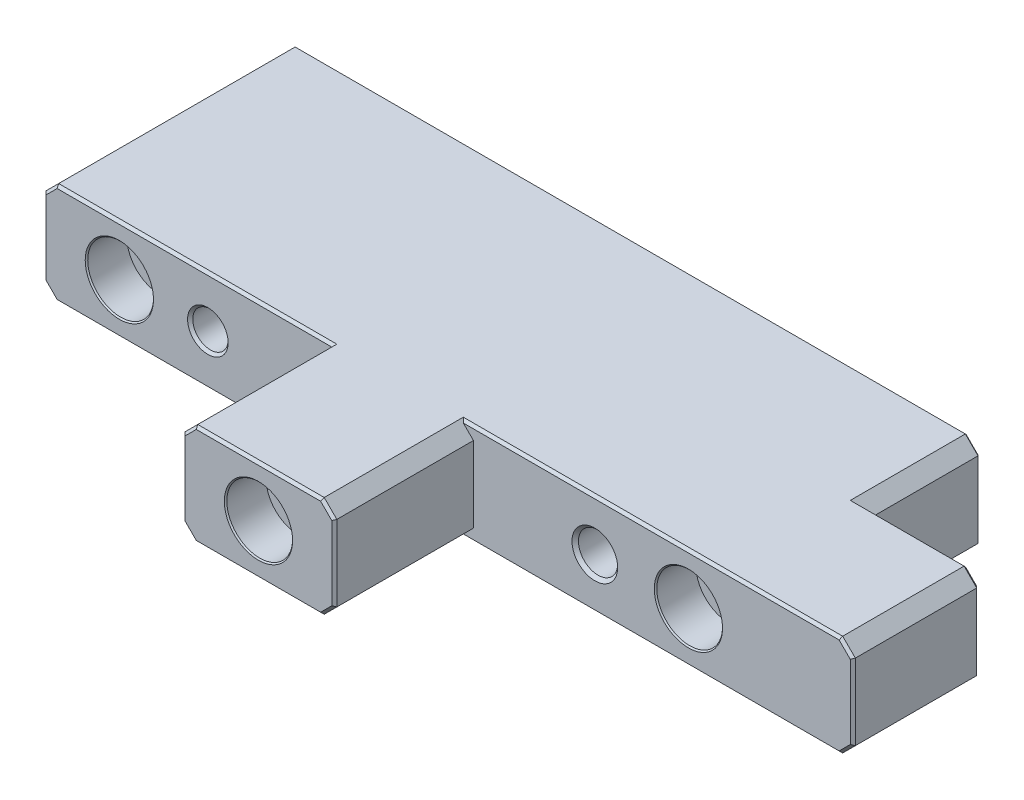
SolidWorks part; units mm, degrees
ref_plane "Plan de face" through (0, 0, 0) normal (0, 0, 1) x (1, 0, 0)
ref_plane "Plan de dessus" through (0, 0, 0) normal (0, 1, 0) x (1, 0, 0)
ref_plane "Plan de droite" through (0, 0, 0) normal (1, 0, 0) x (0, 0, -1)
sketch "Esquisse1" plane through (0, 0, 0) normal (0, 0, 1) x (1, 0, 0)
  line L0 (0, 40) -> (0, 0)
  line L1 (0, 0) -> (320, 0)
  line L2 (320, 0) -> (320, 40)
  line L3 (320, 40) -> (0, 40)
  dimension "D1" = 320
  dimension "D2" = 40
extrude "Volume" add sketch "Esquisse1" along normal blind 150
sketch "Esquisse5" plane through (0, 40, 0) normal (0, 1, 0) x (1, 0, 0)
  line L1 (340, -170) -> (170, -170)
  line L2 (340, -170) -> (340, -95)
  line L3 (340, -95) -> (170, -95)
  line L4 (170, -170) -> (170, -95)
  line L5 (320, 0) -> (0, 0) construction
  line L6 (320, -150) -> (0, -150) construction
  line L7 (320, -150) -> (320, 0) construction
  line L8 (0, -150) -> (0, 0) construction
  line L9 (275, 25) -> (340, 25)
  line L10 (275, 25) -> (275, -45)
  line L11 (275, -45) -> (340, -45)
  line L12 (340, 25) -> (340, -45)
  line L13 (-20, -95) -> (110, -95)
  line L14 (-20, -95) -> (-20, -170)
  line L15 (-20, -170) -> (110, -170)
  line L16 (110, -95) -> (110, -170)
  dimension "D1" = 45
  dimension "D2" = 95
  dimension "D3" = 20
  dimension "D4" = 20
  dimension "D5" = 45
  dimension "D6" = 25
  dimension "D7" = 20
  dimension "D8" = 150
  dimension "D9" = 20
  dimension "D10" = 60
extrude "Evidemments" cut sketch "Esquisse5" against normal through all
sketch "Position lamage 1 - Vis CHc M16" plane through (0, 0, 150) normal (0, 0, 1) x (1, 0, 0)
  line L0 (110, 0) -> (170, 0) construction
  line L2 (170, 40) -> (170, 0) construction
  point P0 (140, 20)
  dimension "D1" = 20
  dimension "D2" = 30
sketch "Position lamage 2 - Vis CHc M16" plane through (0, 0, 95) normal (0, 0, 1) x (1, 0, 0)
  line L0 (320, 0) -> (170, 0) construction
  line L1 (320, 40) -> (320, 0) construction
  point P0 (255, 20)
  point P6 (30, 20)
  dimension "D1" = 20
  dimension "D2" = 115
  dimension "D3" = 65
  dimension "D4" = 110
hole_wizard "Lamage vis M16" positions "Esquisse3D4" profile "Esquisse8" counterbore size "M16" standard "ISO"
sketch3d "Esquisse3D4"
  point P0 (140, 20, 150)
  point P3 (255, 20, 95)
  point P6 (30, 20, 95)
sketch "Esquisse8" plane through (140, 20, 150) normal (1, 0, 0) x (0, -1, 0)
  line L0 (0, 0) -> (0, 150)
  line L1 (0, 150) -> (8.75, 150)
  line L3 (8.75, 150) -> (8.75, 16)
  line L4 (8.75, 16) -> (13, 16)
  line L5 (13, 16) -> (13, 0)
  line L7 (13, 0) -> (0, 0)
  line L11 (0, -6.35) -> (0, 107.95) construction
  dimension "Diamètre du perçage jusqu'au prochain" = 17.5
  dimension "Profondeur du perçage jusqu'au prochain" = 150
  dimension "Diamètre du chambrage" = 26
  dimension "Profondeur du chambrage" = 16
sketch "Position taraudage M18" plane through (0, 0, 95) normal (0, 0, 1) x (1, 0, 0)
  point P0 (218, 20)
  dimension "D1" = 78
hole_wizard "Trou taraudé M18" positions "Esquisse3D5" profile "Esquisse10" tap size "M18" standard "DIN"
sketch3d "Esquisse3D5"
  point P0 (218, 20, 95)
sketch "Esquisse10" plane through (218, 20, 95) normal (1, 0, 0) x (0, -1, 0)
  line L0 (0, 0) -> (0, 53.1567)
  line L1 (0, 53.1567) -> (7.75, 48.5)
  line L2 (7.75, 48.5) -> (7.75, 1.275)
  line L3 (7.75, 1.275) -> (9.025, 0)
  line L5 (9.025, 0) -> (0, 0)
  line L6 (-7.75, 1.275) -> (-9.025, 0) construction
  line L10 (0, 53.1567) -> (-7.75, 48.5) construction
  line L11 (0, -6.35) -> (0, 107.95) construction
  dimension "Diamètre du trou pour taraudage" = 15.5
  dimension "Profondeur du trou pour taraudage" = 48.5
  dimension "Diamètre du fraisage entrant" = 18.05
  dimension "Angle du fraisage entrant" = 90
  dimension "Angle de pointe" = 118
sketch "Position taraudage M16" plane through (0, 0, 95) normal (0, 0, 1) x (1, 0, 0)
  point P0 (65, 20)
  dimension "D1" = 75
hole_wizard "Trou taraudé M16" positions "Esquisse16" profile "Esquisse15" tap size "M16" standard "DIN"
sketch "Esquisse16" plane through (0, 0, 95) normal (0, 0, 1) x (1, 0, 0)
  point P0 (65, 20)
sketch "Esquisse15" plane through (65, 20, 95) normal (1, 0, 0) x (0, -1, 0)
  line L0 (0, 0) -> (0, 46.206)
  line L1 (0, 46.206) -> (7, 42)
  line L2 (7, 42) -> (7, 1.025)
  line L3 (7, 1.025) -> (8.025, 0)
  line L5 (8.025, 0) -> (0, 0)
  line L6 (-7, 1.025) -> (-8.025, 0) construction
  line L10 (0, 46.206) -> (-7, 42) construction
  line L11 (0, -6.35) -> (0, 107.95) construction
  dimension "Diamètre du trou pour taraudage" = 14
  dimension "Profondeur du trou pour taraudage" = 42
  dimension "Diamètre du fraisage entrant" = 16.05
  dimension "Angle du fraisage entrant" = 90
  dimension "Angle de pointe" = 118
sketch "Position M16 - Butée" plane through (0, 0, 0) normal (0, -1, 0) x (1, 0, 0)
  line L1 (0, 0) -> (275, 0) construction
  line L2 (140, 0) -> (140, 134) construction
  point P0 (300, 70)
  dimension "D1" = 160
  dimension "D2" = 70
hole_wizard "Trou taraudé M16 - Butée" positions "Esquisse13" profile "Esquisse12" tap size "M16" standard "DIN"
sketch "Esquisse13" plane through (0, 0, 0) normal (0, -1, 0) x (1, 0, 0)
  point P0 (300, 70)
sketch "Esquisse12" plane through (300, 0, 70) normal (1, 0, 0) x (0, 0, -1)
  line L0 (0, 0) -> (0, 29.206)
  line L1 (0, 29.206) -> (7, 25)
  line L2 (7, 25) -> (7, 1.025)
  line L3 (7, 1.025) -> (8.025, 0)
  line L5 (8.025, 0) -> (0, 0)
  line L6 (-7, 1.025) -> (-8.025, 0) construction
  line L10 (0, 29.206) -> (-7, 25) construction
  line L11 (0, -6.35) -> (0, 107.95) construction
  dimension "Diamètre du trou pour taraudage" = 14
  dimension "Profondeur du trou pour taraudage" = 25
  dimension "Diamètre du fraisage entrant" = 16.05
  dimension "Angle du fraisage entrant" = 90
  dimension "Angle de pointe" = 118
chamfer "Chanfreins 5mm" distance 5 angle 45 10 edges at (320, 0, 70) (320, 40, 70) (170, 40, 122.5) (170, 0, 122.5) (0, 0, 47.5) (0, 40, 47.5) (275, 0, 22.5) (275, 40, 22.5) (110, 40, 122.5) (110, 0, 122.5)
chamfer "Chanfreins 1mm" distance 1 angle 45 23 edges at (240, 0, 95) (317.5, 2.5, 95) (320, 20, 95) (317.5, 37.5, 95) (240, 40, 95) (140, 40, 150) (167.5, 37.5, 150) (170, 20, 150) (167.5, 2.5, 150) (140, 0, 150) (292.5, 0, 45) (292.5, 40, 45) (317.5, 2.5, 45) (320, 20, 45) (317.5, 37.5, 45) (60, 40, 95) (2.5, 37.5, 95) (0, 20, 95) (2.5, 2.5, 95) (60, 0, 95) (112.5, 2.5, 150) (110, 20, 150) (112.5, 37.5, 150)
chamfer "Chanfreins 0.5mm" distance 0.5 angle 45 14 edges at (137.5, 40, 0) (2.5, 37.5, 0) (0, 20, 0) (2.5, 2.5, 0) (137.5, 0, 0) (255, 11.25, 0) (148.75, 20, 0) (255, 7, 95) (153, 20, 150) (275, 20, 0) (272.5, 37.5, 0) (272.5, 2.5, 0) (38.75, 20, 0) (43, 20, 95)
